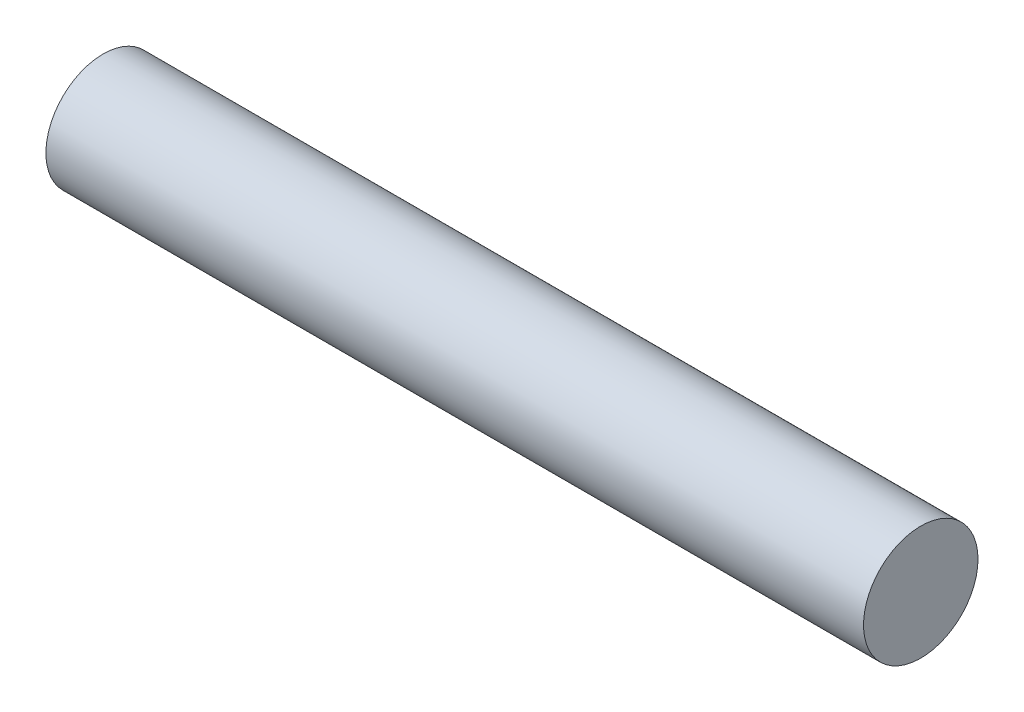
SolidWorks part; units mm, degrees
ref_plane "Front" through (0, 0, 0) normal (0, 0, 1) x (1, 0, 0)
ref_plane "Top" through (0, 0, 0) normal (0, 1, 0) x (1, 0, 0)
ref_plane "Right" through (0, 0, 0) normal (1, 0, 0) x (0, 0, -1)
sketch "Sketch1" plane through (0, 0, 0) normal (1, 0, 0) x (0, 0, -1)
  circle A0 centre (0, 0) radius 21
  dimension "d" = 42
extrude "Base" add sketch "Sketch1" along normal blind 300
sketch "Sketch2" plane through (0, 0, 0) normal (0, 0, 1) x (1, 0, 0)
  line L0 (300, 19.5936) -> (300.812, 21)
  line L1 (300.812, 21) -> (300.812, 21.5)
  line L2 (300.812, 21.5) -> (299.188, 21.5)
  line L3 (299.188, 21.5) -> (299.188, 21)
  line L4 (299.188, 21) -> (300, 19.5936)
  line L5 (0, 0) -> (325.0946, 0) construction
  line L6 (300, -21) -> (300, 21) construction
  dimension "D1" = 60
  dimension "D2" = 60
  dimension "D3" = 0.5
  dimension "D4" = 1.624
  dimension "D5" = 42
revolve "Cut-Revolve10" [suppressed] cut sketch "Sketch2" angle 360 about L5
pattern_linear "LPattern10" [suppressed] count 15 spacing 19.488 along (1, 0, 0)
equation "\"D5@Sketch2\" = \"d@Sketch1\""
equation "\"D4@Sketch2\" = (  \"d@Sketch1\" - \"D2@ThreadCosmetic1\" )  / 2"
equation "\"D3@LPattern10\" = \"D4@Sketch2\" * 1.2 * 10"
equation "\"D1@LPattern10\" = \"l@Base\" / \"D3@LPattern10\""
